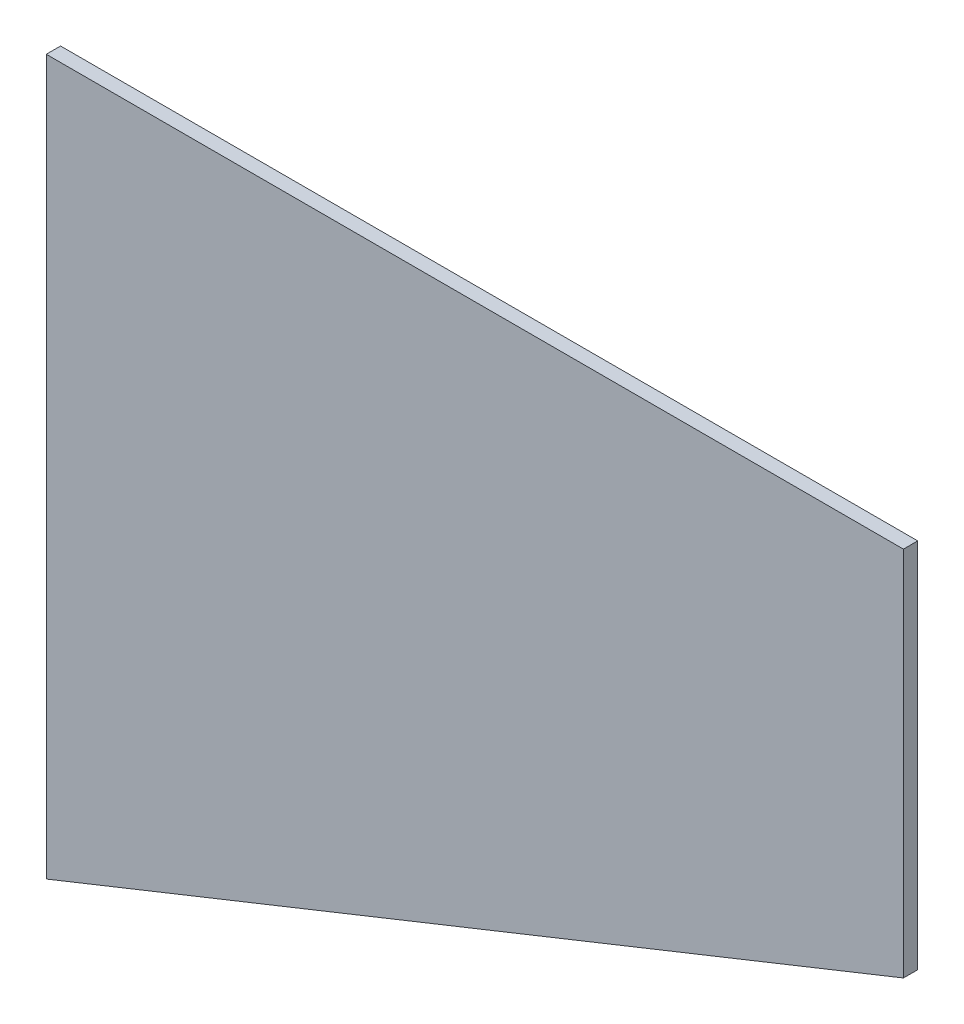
SolidWorks part; units mm, degrees
ref_plane "Front Plane" through (0, 0, 0) normal (1, 0, 0) x (0, 1, 0)
ref_plane "Top Plane" through (0, 0, 0) normal (0, 0, 1) x (0, 1, 0)
ref_plane "Right Plane" through (0, 0, 0) normal (0, 1, 0) x (-1, 0, 0)
sketch "Sketch1" plane through (0, 0, 0) normal (1, 0, 0) x (0, 1, 0)
  line L1 (-158.75, 152.4) -> (158.75, 152.4)
  line L2 (-158.75, 152.4) -> (-158.75, 158.75)
  line L3 (-158.75, 158.75) -> (158.75, 158.75)
  line L4 (158.75, 152.4) -> (158.75, 158.75)
ref_plane "Plane1" through (304.8, 0, 0) normal (1, 0, 0) x (0, 1, 0)
sketch "Sketch2" plane through (304.8, 0, 0) normal (1, 0, 0) x (0, 1, 0)
  line L1 (-82.55, 76.2) -> (82.55, 76.2)
  line L2 (-82.55, 76.2) -> (-82.55, 82.55)
  line L3 (-82.55, 82.55) -> (82.55, 82.55)
  line L4 (82.55, 76.2) -> (82.55, 82.55)
loft "Tapered_plywood_panel" add profiles "Sketch1", "Sketch2"
